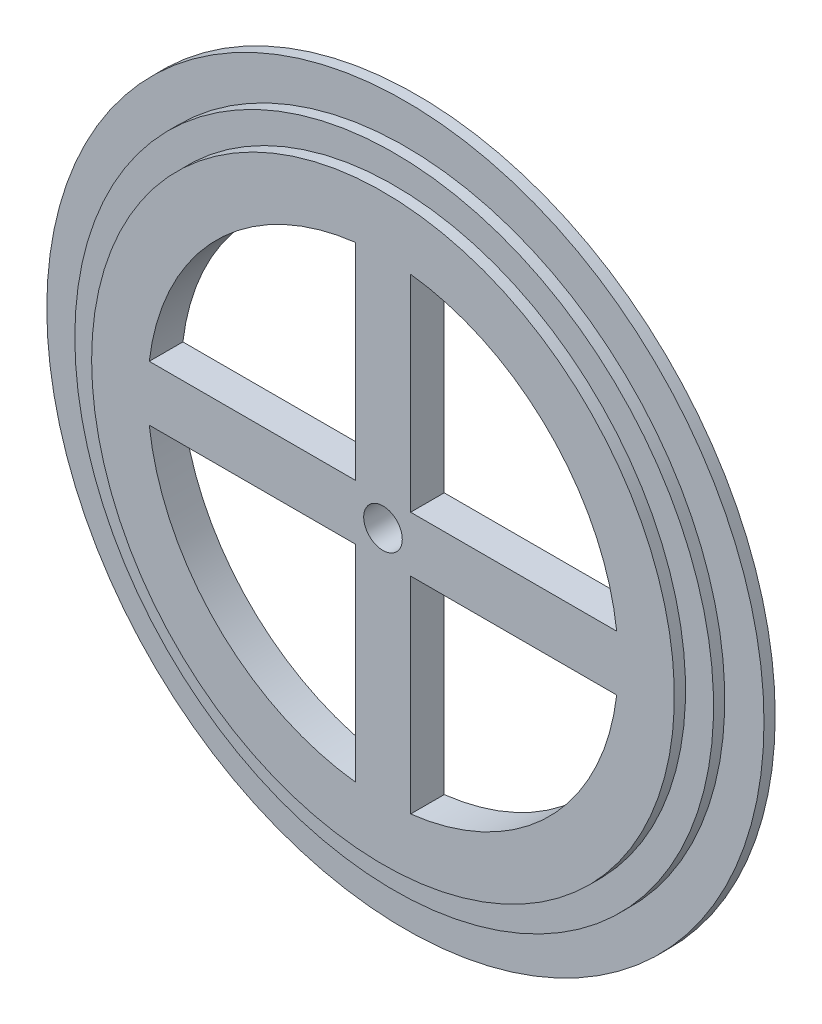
SolidWorks part; units mm, degrees
ref_plane "Front Plane" through (0, 0, 0) normal (0, 0, 1) x (1, 0, 0)
ref_plane "Top Plane" through (0, 0, 0) normal (0, 1, 0) x (1, 0, 0)
ref_plane "Right Plane" through (0, 0, 0) normal (1, 0, 0) x (0, 0, -1)
sketch "Sketch1" plane through (0, 0, 0) normal (1, 0, 0) x (0, 0, -1)
  line L0 (0, 0) -> (0, 82.55)
  line L1 (0, 82.55) -> (3.175, 82.55)
  line L2 (3.175, 82.55) -> (3.175, 90.4875)
  line L3 (3.175, 90.4875) -> (6.35, 90.4875)
  line L4 (6.35, 90.4875) -> (6.35, 101.6)
  line L5 (6.35, 101.6) -> (9.525, 101.6)
  line L6 (9.525, 101.6) -> (9.525, 0)
  line L7 (9.525, 0) -> (0, 0)
  point P10 (-0.9407, 0)
  dimension "D1" = 3.175
  dimension "D2" = 82.55
  dimension "D3" = 90.4875
  dimension "D4" = 101.6
revolve "Revolve1" add sketch "Sketch1" angle 360 about L7
sketch "Sketch2" plane through (0, 0, 0) normal (0, 0, 1) x (1, 0, 0)
  line L0 (7.8299, 66.2137) -> (7.8299, 7.8299)
  line L1 (7.8299, 7.8299) -> (66.2137, 7.8299)
  line L2 (0, 0) -> (7.8299, 7.8299) construction
  line L3 (0, 0) -> (11.8393, 0) construction
  line L4 (66.2137, -7.8299) -> (7.8299, -7.8299)
  line L5 (7.8299, -7.8299) -> (7.8299, -66.2137)
  line L6 (-7.8299, -66.2137) -> (-7.8299, -7.8299)
  line L7 (-7.8299, -7.8299) -> (-66.2137, -7.8299)
  line L8 (-66.2137, 7.8299) -> (-7.8299, 7.8299)
  line L9 (-7.8299, 7.8299) -> (-7.8299, 66.2137)
  circle A0 centre (0, 0) radius 66.675
  circle A1 centre (0, 0) radius 5.4657
  point P19 (0, 0)
  dimension "D1" = 45
  dimension "D2" = 133.35
  dimension "D3" = 4
extrude "Cut-Extrude1" cut sketch "Sketch2" against normal through all contours L9 A0 L8 | L1 A0 L0 | L5 A0 L4 | L7 A0 L6 | A1
